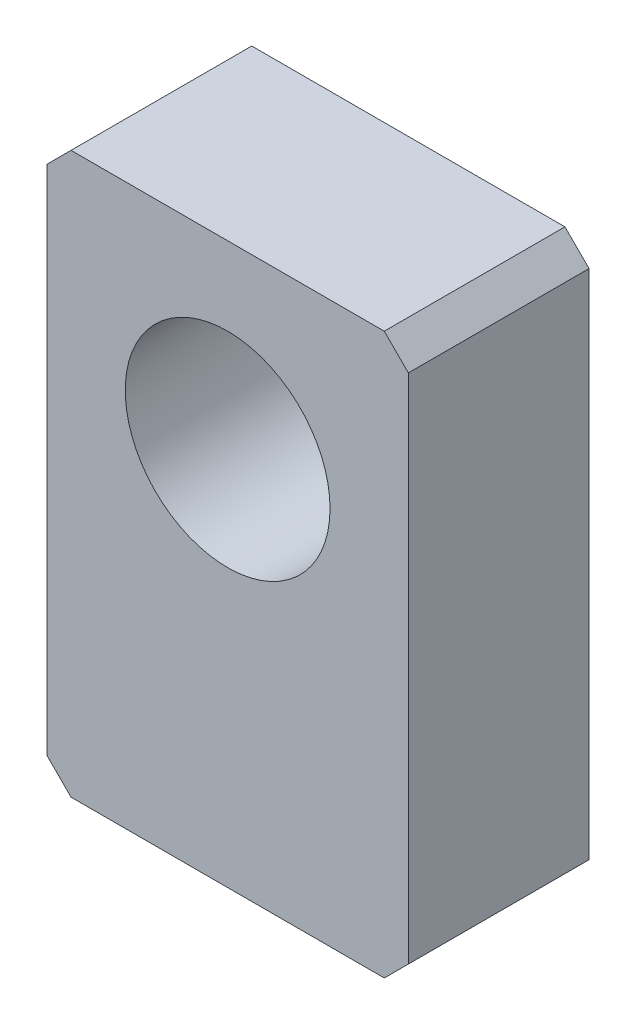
SolidWorks part; units mm, degrees
ref_plane "前视基准面" through (0, 0, 0) normal (0, 0, 1) x (1, 0, 0)
ref_plane "上视基准面" through (0, 0, 0) normal (0, 1, 0) x (1, 0, 0)
ref_plane "右视基准面" through (0, 0, 0) normal (1, 0, 0) x (0, 0, -1)
other "Configuration Table"
sketch "草图1" plane through (0, 0, 0) normal (0, 0, 1) x (1, 0, 0)
  line L0 (-2.6, -6.3) -> (2.6, -6.3)
  line L1 (2.6, -6.3) -> (3, -5.9)
  line L2 (3, -5.9) -> (3, 2.6)
  line L3 (3, 2.6) -> (2.6, 3)
  line L4 (2.6, 3) -> (-2.6, 3)
  line L5 (-2.6, 3) -> (-3, 2.6)
  line L6 (-3, 2.6) -> (-3, -5.9)
  line L7 (-3, -5.9) -> (-2.6, -6.3)
  circle A0 centre (0, 0) radius 1.7
  dimension "D1" = 3.4
  dimension "D2" = 2.6
  dimension "D3" = 3
  dimension "D4" = 2.6
  dimension "D5" = 2.6
  dimension "D6" = 3
  dimension "D7" = 5.9
extrude "Edge_clip_M3_clearance" add sketch "草图1" along normal blind 3
